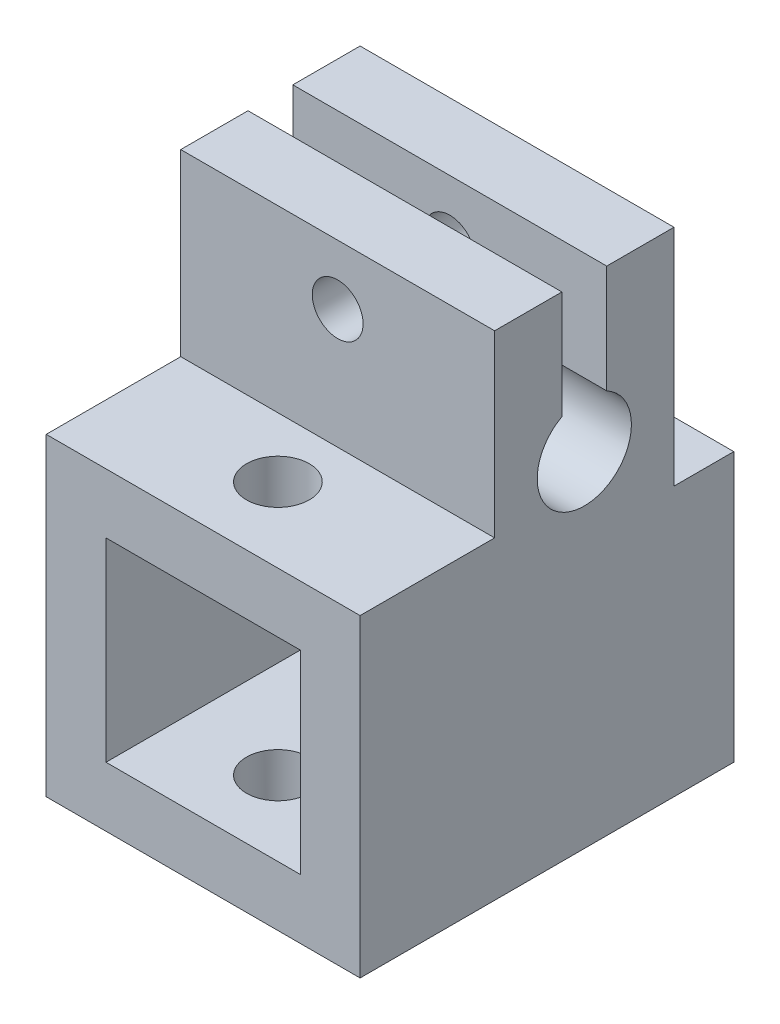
SolidWorks part; units mm, degrees
ref_plane "前视基准面" through (0, 0, 0) normal (0, 0, 1) x (1, 0, 0)
ref_plane "上视基准面" through (0, 0, 0) normal (0, 1, 0) x (1, 0, 0)
ref_plane "右视基准面" through (0, 0, 0) normal (1, 0, 0) x (0, 0, -1)
other "Configuration Table"
sketch "草图2" plane through (0, 0, 0) normal (0, 0, 1) x (1, 0, 0)
  line L1 (-7.5, 7.5) -> (7.5, 7.5)
  line L2 (-7.5, 7.5) -> (-7.5, -7.5)
  line L3 (-7.5, -7.5) -> (7.5, -7.5)
  line L4 (7.5, 7.5) -> (7.5, -7.5)
  line L5 (-7.5, 7.5) -> (7.5, -7.5) construction
  line L6 (-7.5, -7.5) -> (7.5, 7.5) construction
  point P0 (0, 0)
  dimension "D1" = 15
  dimension "D2" = 15
extrude "凸台-拉伸1" add sketch "草图2" along normal blind 25
sketch "草图3" plane through (0, 0, 25) normal (0, 0, 1) x (1, 0, 0)
  line L1 (-6.5, 6.5) -> (6.5, 6.5)
  line L2 (-6.5, 6.5) -> (-6.5, -6.5)
  line L3 (-6.5, -6.5) -> (6.5, -6.5)
  line L4 (6.5, 6.5) -> (6.5, -6.5)
  line L5 (-6.5, 6.5) -> (6.5, -6.5) construction
  line L6 (-6.5, -6.5) -> (6.5, 6.5) construction
  point P0 (0, 0)
  dimension "D1" = 13
  dimension "D2" = 13
extrude "切除-拉伸1" cut sketch "草图3" against normal blind 20
sketch "草图6" plane through (0, 7.5, 0) normal (0, 1, 0) x (1, 0, 0)
  line L0 (7.5, -25) -> (7.5, 0) construction
  line L1 (-7.5, 0) -> (7.5, 0)
  line L2 (-7.5, 0) -> (-7.5, -15)
  line L3 (-7.5, -15) -> (7.5, -15)
  line L4 (7.5, 0) -> (7.5, -15)
  dimension "D1" = 15
extrude "凸台-拉伸2" add sketch "草图6" along normal blind 15
sketch "草图7" plane through (7.5, 0, 0) normal (1, 0, 0) x (0, 0, -1)
  line L1 (-25, -7.5) -> (-25, 7.5) construction
  line L2 (-15, 22.5) -> (0, 22.5) construction
  circle A0 centre (-10, 12.5) radius 3.15
  dimension "D1" = 6.3
  dimension "D2" = 15
  dimension "D3" = 10
extrude "切除-拉伸2" cut sketch "草图7" against normal blind 15
sketch "草图8" plane through (0, 22.5, 0) normal (0, 1, 0) x (1, 0, 0)
  line L0 (7.5, -15) -> (7.5, 0) construction
  line L1 (-7.5, 0) -> (7.5, 0)
  line L2 (-7.5, 0) -> (-7.5, -3)
  line L3 (-7.5, -3) -> (7.5, -3)
  line L4 (7.5, 0) -> (7.5, -3)
  dimension "D1" = 3
extrude "切除-拉伸3" cut sketch "草图8" against normal blind 15
sketch "草图12" plane through (7.5, 0, 0) normal (1, 0, 0) x (0, 0, -1)
  line L0 (-3, 7.5) -> (-3, 22.5) construction
  line L1 (-11.5, 23.253) -> (-8.5, 23.253)
  line L2 (-11.5, 23.253) -> (-11.5, 13.0541)
  line L3 (-11.5, 13.0541) -> (-8.5, 13.0541)
  line L4 (-8.5, 23.253) -> (-8.5, 13.0541)
  dimension "D1" = 3
  dimension "D2" = 5.5
extrude "切除-拉伸5" cut sketch "草图12" against normal blind 15
sketch "草图15" plane through (0, 0, 3) normal (0, 0, -1) x (-1, 0, 0)
  line L1 (-7.5, 22.5) -> (7.5, 22.5)
  line L2 (-7.5, 22.5) -> (-7.5, 7.5)
  line L3 (-7.5, 7.5) -> (7.5, 7.5)
  line L4 (7.5, 22.5) -> (7.5, 7.5)
extrude "切除-拉伸6" cut sketch "草图15" against normal blind 1
sketch "草图16" plane through (0, 0, 15) normal (0, 0, 1) x (1, 0, 0)
  line L1 (-7.5, 22.5) -> (7.5, 22.5)
  line L2 (-7.5, 22.5) -> (-7.5, 7.5)
  line L3 (-7.5, 7.5) -> (7.5, 7.5)
  line L4 (7.5, 22.5) -> (7.5, 7.5)
extrude "凸台-拉伸3" add sketch "草图16" along normal blind 1
hole_wizard "M3 十字槽沉头木螺钉的锥形沉头孔1" positions "草图17" profile "草图18" countersink size "M3" standard "GB"
sketch "草图17" plane through (0, 0, 4) normal (0, 0, -1) x (-1, 0, 0)
  line L0 (7.5, 22.5) -> (-7.5, 22.5) construction
  line L1 (7.5, 7.5) -> (7.5, 22.5) construction
  point P0 (0, 18.5)
  dimension "D1" = 4
  dimension "D2" = 7.5
sketch "草图18" plane through (0, 18.5, 4) normal (1, 0, 0) x (0, 1, 0)
  line L0 (0, 0) -> (0, 21)
  line L1 (0, 21) -> (1.7, 21)
  line L2 (1.7, 21) -> (1.7, 1.6)
  line L3 (1.7, 1.6) -> (3.3, 0)
  line L5 (3.3, 0) -> (0, 0)
  line L6 (-1.7, 1.6) -> (-3.3, 0) construction
  line L11 (0, -6.35) -> (0, 107.95) construction
  dimension "通孔孔直径" = 3.4
  dimension "通孔孔深度" = 21
  dimension "近端锥形沉头孔直径" = 6.6
  dimension "近端锥形沉头孔角度" = 90
sketch "草图19" plane through (0, 7.5, 0) normal (0, 1, 0) x (1, 0, 0)
  line L1 (-7.5, -16) -> (7.5, -16)
  line L2 (-7.5, -16) -> (-7.5, -25)
  line L3 (-7.5, -25) -> (7.5, -25)
  line L4 (7.5, -16) -> (7.5, -25)
extrude "凸台-拉伸4" add sketch "草图19" along normal blind 3
sketch "草图20" plane through (0, -7.5, 0) normal (0, -1, 0) x (1, 0, 0)
  line L0 (7.5, 25) -> (7.5, 0) construction
  line L1 (-7.5, 25) -> (7.5, 25)
  line L2 (-7.5, 25) -> (-7.5, 0)
  line L3 (-7.5, 0) -> (7.5, 0)
  line L4 (7.5, 25) -> (7.5, 0)
extrude "凸台-拉伸5" add sketch "草图20" along normal blind 3
sketch "草图21" plane through (-7.5, 0, 0) normal (-1, 0, 0) x (0, 0, 1)
  line L11 (4, 22.5) -> (4, 7.5)
  line L12 (4, 7.5) -> (0, 7.5)
  line L13 (0, 7.5) -> (0, -10.5)
  line L14 (0, -10.5) -> (25, -10.5)
  line L15 (25, -10.5) -> (25, 10.5)
  line L16 (25, 10.5) -> (16, 10.5)
  line L17 (16, 10.5) -> (16, 22.5)
  line L18 (16, 22.5) -> (11.5, 22.5)
  line L19 (11.5, 22.5) -> (11.5, 15.2699)
  line L20 (8.5, 15.2699) -> (8.5, 22.5)
  line L21 (8.5, 22.5) -> (4, 22.5)
  line L22 (4, 22.5) -> (4, 7.5)
  line L23 (4, 7.5) -> (0, 7.5)
  line L24 (0, 7.5) -> (0, -10.5)
  line L25 (0, -10.5) -> (25, -10.5)
  line L26 (25, -10.5) -> (25, 10.5)
  line L27 (25, 10.5) -> (16, 10.5)
  line L28 (16, 10.5) -> (16, 22.5)
  line L29 (16, 22.5) -> (11.5, 22.5)
  line L30 (11.5, 22.5) -> (11.5, 15.2699)
  line L31 (8.5, 15.2699) -> (8.5, 22.5)
  line L32 (8.5, 22.5) -> (4, 22.5)
  arc A1 (8.5, 15.2699) -> (11.5, 15.2699) centre (10, 12.5) ccw
  arc A2 (8.5, 15.2699) -> (11.5, 15.2699) centre (10, 12.5) ccw
  dimension "D1" = 0
extrude "凸台-拉伸6" add sketch "草图21" along normal blind 3
sketch "草图22" plane through (7.5, 0, 0) normal (1, 0, 0) x (0, 0, -1)
  line L11 (0, 7.5) -> (-4, 7.5)
  line L12 (-4, 7.5) -> (-4, 22.5)
  line L13 (-4, 22.5) -> (-8.5, 22.5)
  line L14 (-8.5, 22.5) -> (-8.5, 15.2699)
  line L15 (-11.5, 15.2699) -> (-11.5, 22.5)
  line L16 (-11.5, 22.5) -> (-16, 22.5)
  line L17 (-16, 22.5) -> (-16, 10.5)
  line L18 (-16, 10.5) -> (-25, 10.5)
  line L19 (-25, 10.5) -> (-25, -10.5)
  line L20 (-25, -10.5) -> (0, -10.5)
  line L21 (0, -10.5) -> (0, 7.5)
  line L22 (0, 7.5) -> (-4, 7.5)
  line L23 (-4, 7.5) -> (-4, 22.5)
  line L24 (-4, 22.5) -> (-8.5, 22.5)
  line L25 (-8.5, 22.5) -> (-8.5, 15.2699)
  line L26 (-11.5, 15.2699) -> (-11.5, 22.5)
  line L27 (-11.5, 22.5) -> (-16, 22.5)
  line L28 (-16, 22.5) -> (-16, 10.5)
  line L29 (-16, 10.5) -> (-25, 10.5)
  line L30 (-25, 10.5) -> (-25, -10.5)
  line L31 (-25, -10.5) -> (0, -10.5)
  line L32 (0, -10.5) -> (0, 7.5)
  arc A1 (-11.5, 15.2699) -> (-8.5, 15.2699) centre (-10, 12.5) ccw
  arc A2 (-11.5, 15.2699) -> (-8.5, 15.2699) centre (-10, 12.5) ccw
  dimension "D1" = 0
extrude "凸台-拉伸7" add sketch "草图22" along normal blind 3
hole_wizard "M5 螺纹孔1" positions "草图23" profile "草图24" tap size "M5" standard "GB"
sketch "草图23" plane through (0, 10.5, 0) normal (0, 1, 0) x (1, 0, 0)
  line L0 (-10.5, -25) -> (10.5, -25) construction
  line L1 (10.5, -16) -> (10.5, -25) construction
  point P0 (0, -20)
  dimension "D1" = 5
  dimension "D2" = 10.5
sketch "草图24" plane through (0, 10.5, 20) normal (1, 0, 0) x (0, 0, 1)
  line L0 (0, 0) -> (0, 21)
  line L1 (0, 21) -> (2.1, 21)
  line L2 (2.1, 21) -> (2.1, 0)
  line L5 (2.1, 0) -> (0, 0)
  line L11 (0, -6.35) -> (0, 107.95) construction
  dimension "通孔螺纹孔钻头直径" = 4.2
  dimension "通孔螺纹孔钻头深度" = 21
